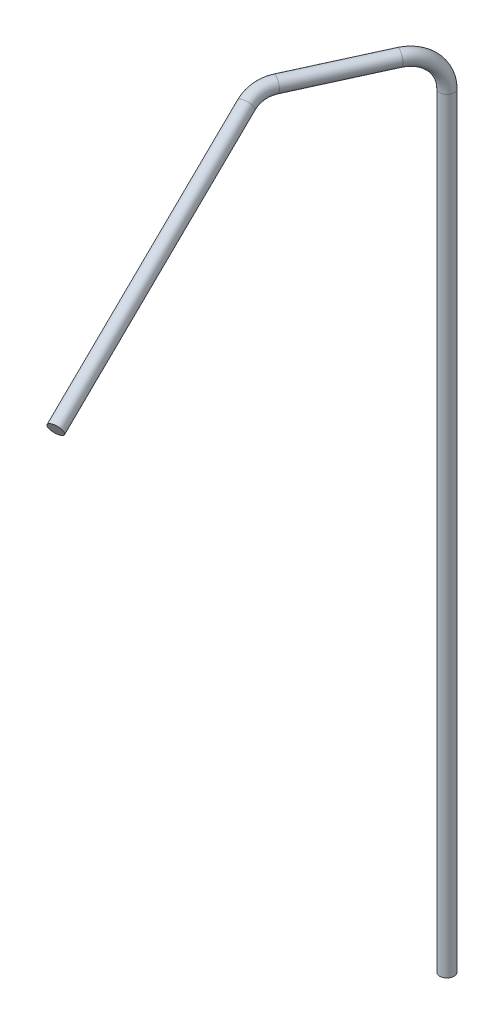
SolidWorks part; units mm, degrees
other "<pièce L>-<Balayage1>"
ref_plane "Plan de face" through (0, 0, 0) normal (0, 0, 1) x (1, 0, 0)
ref_plane "Plan de dessus" through (0, 0, 0) normal (0, 1, 0) x (1, 0, 0)
ref_plane "Plan de droite" through (0, 0, 0) normal (1, 0, 0) x (0, 0, -1)
mirrored part "pièce L_Symétrique"
ref_plane "Plan1" through (0, -345, 0) normal (0, -1, 0) x (-1, 0, 0)
ref_plane "Vue 1" through (-2.7284, 0, -1.2473) normal (-0.9095, 0, -0.4158) x (-0.4158, 0, 0.9095)
